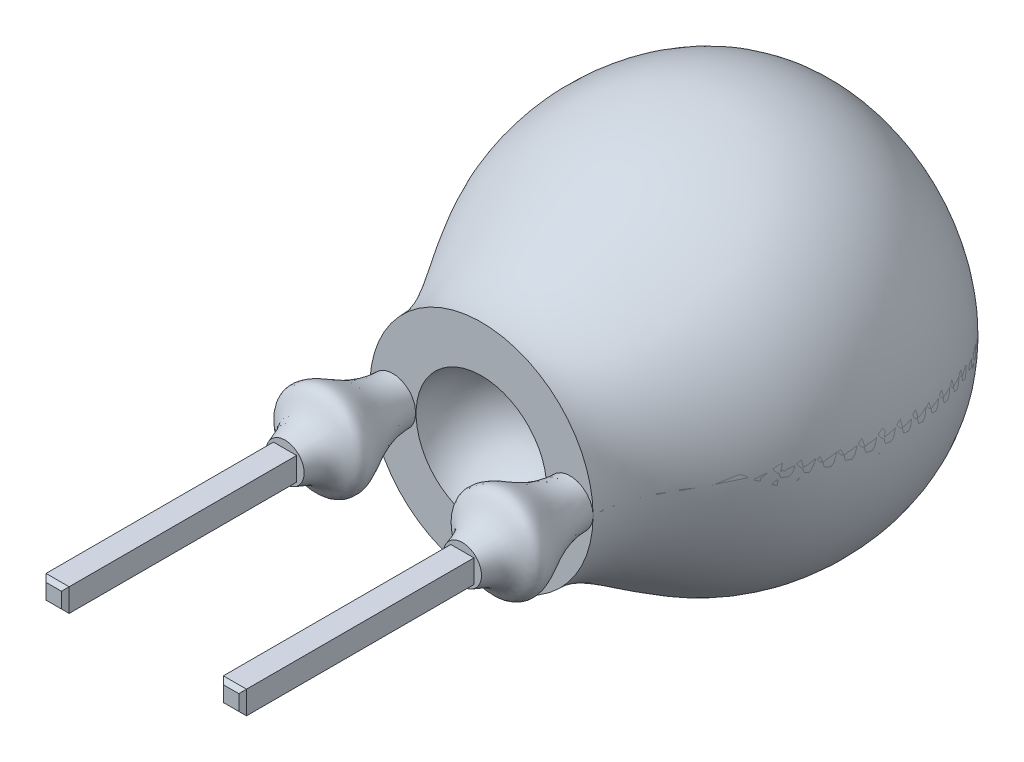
SolidWorks part; units mm, degrees
ref_plane "Plan de face" through (0, 0, 0) normal (0, 0, 1) x (1, 0, 0)
ref_plane "Plan de dessus" through (0, 0, 0) normal (0, 1, 0) x (1, 0, 0)
ref_plane "Plan de droite" through (0, 0, 0) normal (1, 0, 0) x (0, 0, -1)
sketch "Esquisse2" plane through (0, 0, 0) normal (0, 0, 1) x (1, 0, 0)
  circle A0 centre (0, 0) radius 2.5 construction
  circle A3 centre (0, 0) radius 2.5
extrude "Extrusion1" add sketch "Esquisse2" against normal blind 12
sketch "Esquisse5" plane through (0, 0, 0) normal (0, 0, 1) x (1, 0, 0)
  line L0 (0, 1.0031) -> (0, -1.0758) construction
  line L1 (-1.3, 0.15) -> (-1, 0.15)
  line L2 (-1.3, 0.15) -> (-1.3, -0.15)
  line L3 (-1.3, -0.15) -> (-1, -0.15)
  line L4 (-1, 0.15) -> (-1, -0.15)
  line L5 (1.3, 0.15) -> (1.3, -0.15)
  line L6 (1.3, 0.15) -> (1, 0.15)
  line L7 (1, 0.15) -> (1, -0.15)
  line L8 (1.3, -0.15) -> (1, -0.15)
  dimension "D1" = 1
  dimension "D2" = 0.15
  dimension "D3" = 0.15
  dimension "D4" = 1.3
extrude "Extrusion3" add sketch "Esquisse5" along normal blind 3
chamfer "Chanfrein1" distance 0.05 angle 45 8 edges at (1.3, 0, 3) (1.15, -0.15, 3) (1, 0, 3) (1.15, 0.15, 3) (-1, 0, 3) (-1.15, -0.15, 3) (-1.3, 0, 3) (-1.15, 0.15, 3)
sketch "Esquisse6" plane through (0, 0, -12) normal (0, 0, -1) x (-1, 0, 0)
  circle A1 centre (0, 0) radius 2.5
  circle A2 centre (0, 0) radius 2.5
  dimension "D1" = 0
extrude "Enlèv. mat.-Extru.1" cut sketch "Esquisse6" against normal blind 12
sketch "Esquisse7" plane through (0, 0, 0) normal (0, 1, 0) x (-1, 0, 0)
  line L0 (-1.15, -6.3482) -> (-1.15, -0.0002)
  line L1 (-1.3974, -0.0002) -> (-1.15, -0.0002)
  line L3 (-1.15, -0.0002) -> (-1.15, -6.9243) construction
  spline S0 degree 3 poles (-1.3974, -0.0002) (-1.4319, -0.114) (-1.485, -0.2896) (-1.8534, -0.4496) (-0.9721, -1.6659) (-2.9009, -3.1392) (-2.462, -5.8048) (-1.3549, -6.2912) (-1.15, -6.3482) knots 0 0 0 0 0.042098 0.064883 0.127475 0.431078 0.786359 0.864791 0.864791 0.864791 0.864791
revolve "Révolution5" add sketch "Esquisse7" angle 360 about L3
mirror "Symétrie1" about plane through (0, 0, 0) normal (1, 0, 0) of "Révolution5"
sketch "Esquisse9" plane through (0, 0, 0) normal (0, 1, 0) x (1, 0, 0)
  line L0 (0, 0) -> (0, 7.6321) construction
  line L1 (0.8472, 1.397) -> (1.4477, 1.397)
  line L2 (0, 6.3349) -> (0, 2.2441)
  arc A0 (0.8472, 1.397) -> (0, 2.2441) centre (0, 1.397) ccw
  point P0 (1.3974, 0.0002)
  point P1 (1.15, 6.3482)
revolve "Révolution7" add sketch "Esquisse9" angle 360 about L0
